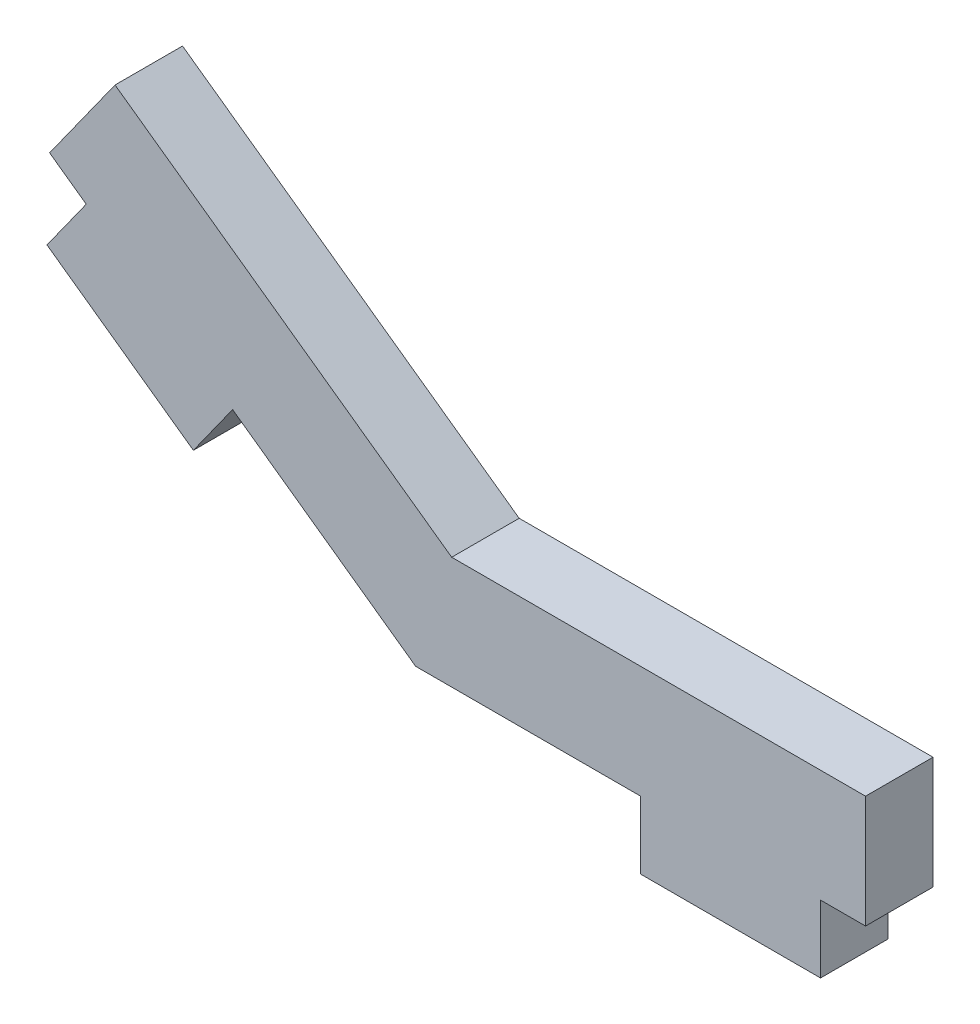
SolidWorks part; units mm, degrees
ref_plane "前视基准面" through (0, 0, 0) normal (0, 0, 1) x (1, 0, 0)
ref_plane "上视基准面" through (0, 0, 0) normal (0, 1, 0) x (1, 0, 0)
ref_plane "右视基准面" through (0, 0, 0) normal (1, 0, 0) x (0, 0, -1)
sketch "草图1" plane through (0, 0, 0) normal (0, 0, 1) x (1, 0, 0)
  line L0 (0, 0) -> (20, 0)
  line L1 (0, 0) -> (-16.2701, 11.6311)
  line L2 (-16.2701, 11.6311) -> (-13.3624, 15.6986)
  line L3 (-13.3624, 15.6986) -> (1.6034, 5)
  line L4 (1.6034, 5) -> (20, 5)
  line L5 (20, 5) -> (20, 0)
  point P3 (3.3637, 3)
  dimension "D1" = 144.44
  dimension "D2" = 5
  dimension "D3" = 20
extrude "凸台-拉伸1" add sketch "草图1" along normal blind 3
sketch "草图2" plane through (0, 0, 3) normal (0, 0, 1) x (1, 0, 0)
  line L0 (0, 0) -> (20, 0) construction
  line L1 (10, 0) -> (18, 0)
  line L2 (10, 0) -> (10, -3)
  line L3 (10, -3) -> (18, -3)
  line L4 (18, 0) -> (18, -3)
  line L5 (-14.6431, 10.468) -> (-8.1351, 5.8156)
  line L6 (-14.6431, 10.468) -> (-16.3878, 8.0275)
  line L7 (-8.1351, 5.8156) -> (-9.8797, 3.375)
  line L8 (-16.3878, 8.0275) -> (-9.8797, 3.375)
  line L9 (-16.2701, 11.6311) -> (0, 0) construction
  dimension "D1" = 8
  dimension "D2" = 3
  dimension "D3" = 10
  dimension "D4" = 10
extrude "凸台-拉伸2" add sketch "草图2" against normal blind 3
